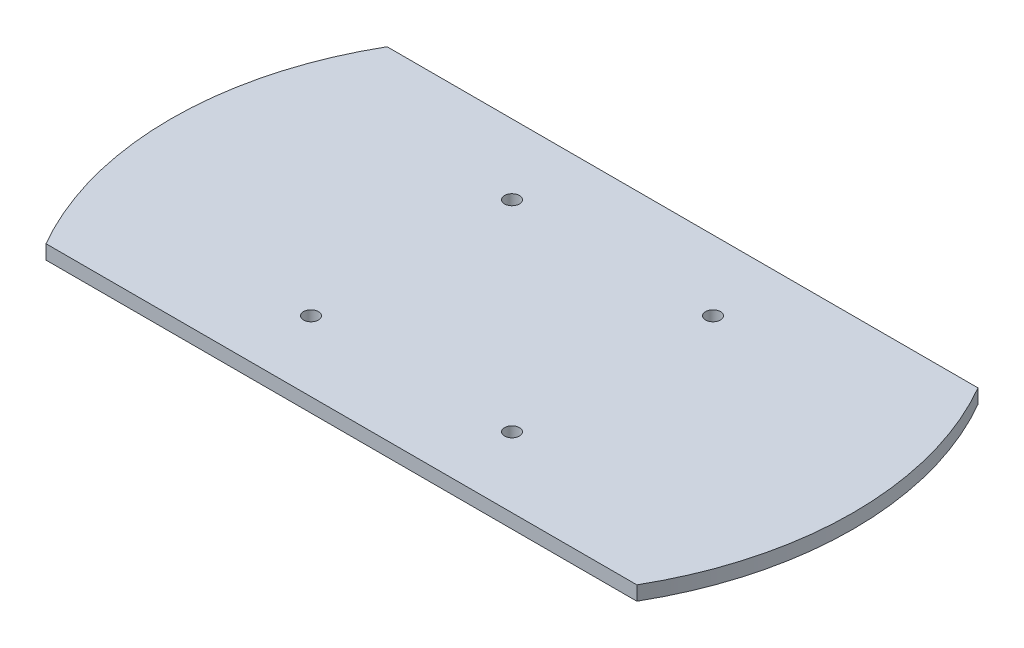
SolidWorks part; units mm, degrees
ref_plane "Front Plane" through (0, 0, 0) normal (0, 0, 1) x (1, 0, 0)
ref_plane "Top Plane" through (0, 0, 0) normal (0, 1, 0) x (1, 0, 0)
ref_plane "Right Plane" through (0, 0, 0) normal (1, 0, 0) x (0, 0, -1)
sketch "Sketch1" plane through (0, 0, 0) normal (0, 1, 0) x (1, 0, 0)
  line L0 (-131.9823, -76.2) -> (131.9823, -76.2)
  line L3 (-131.9823, 76.2) -> (131.9823, 76.2)
  arc A0 (131.9823, -76.2) -> (131.9823, 76.2) centre (0, 0) ccw
  arc A2 (-131.9823, 76.2) -> (-131.9823, -76.2) centre (0, 0) ccw
  dimension "D1" = 152.4
  dimension "D2" = 76.2
extrude "Extrude1" add sketch "Sketch1" along normal blind 6.35
sketch "Sketch2" plane through (0, 6.35, 0) normal (0, 1, 0) x (1, 0, 0)
  line L0 (0, 0) -> (-44.9013, 44.9013)
  line L1 (0, 76.2) -> (0, -76.2) construction
  line L3 (131.9823, 76.2) -> (-131.9823, 76.2) construction
  line L4 (-131.9823, -76.2) -> (131.9823, -76.2) construction
  circle A2 centre (-44.9013, 44.9013) radius 3.302
  circle A3 centre (44.9013, 44.9013) radius 3.302
  circle A4 centre (44.9013, -44.9013) radius 3.302
  circle A5 centre (-44.9013, -44.9013) radius 3.302
extrude "Extrude2" cut sketch "Sketch2" against normal blind 6.35 contours A2 | A5 | A3 | A4
